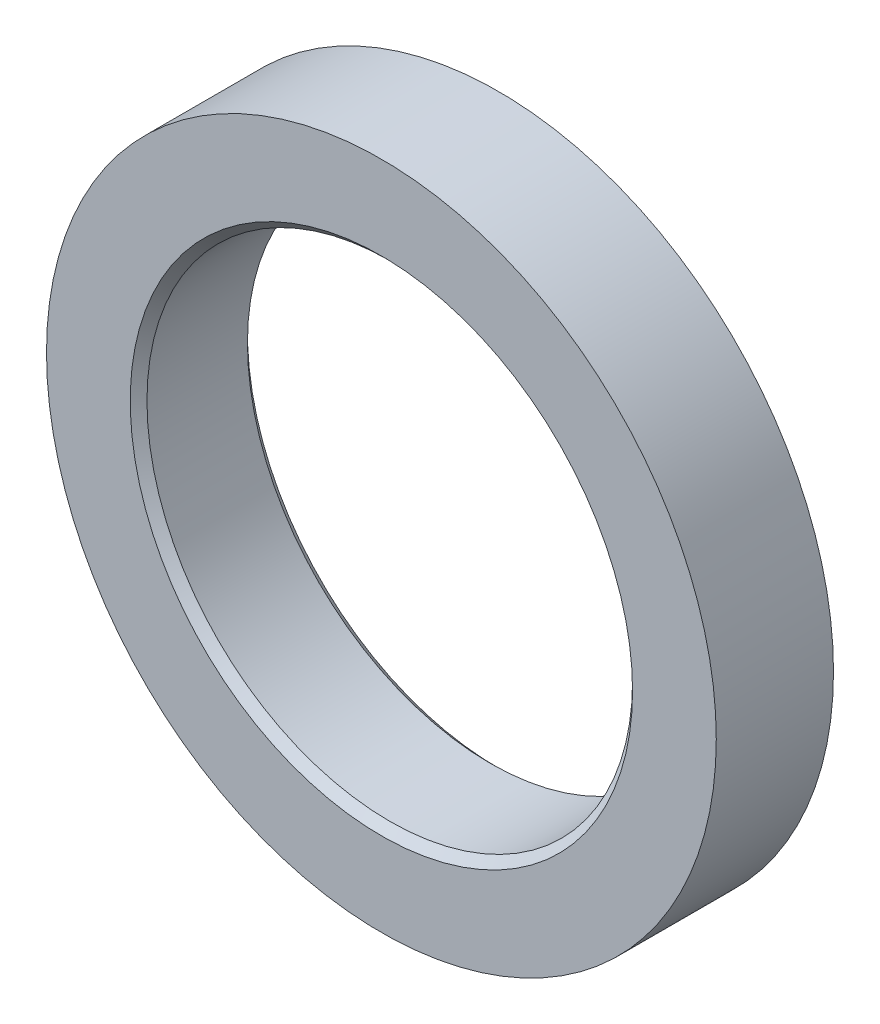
SolidWorks part; units mm, degrees
ref_plane "Front Plane" through (0, 0, 0) normal (0, 0, 1) x (1, 0, 0)
ref_plane "Top Plane" through (0, 0, 0) normal (0, 1, 0) x (1, 0, 0)
ref_plane "Right Plane" through (0, 0, 0) normal (1, 0, 0) x (0, 0, -1)
sketch "Sketch1" plane through (0, 0, 0) normal (0, 0, 1) x (1, 0, 0)
  circle A0 centre (0, 0) radius 5.08
  circle A1 centre (0, 0) radius 3.683
  dimension "D1" = 7.366
  dimension "D2" = 10.16
extrude "Extrude1" add sketch "Sketch1" along normal blind 1.778
chamfer "Chamfer1" distance 0.127 angle 45 2 edges at (3.683, 0, 1.778) (3.683, 0, 0)
